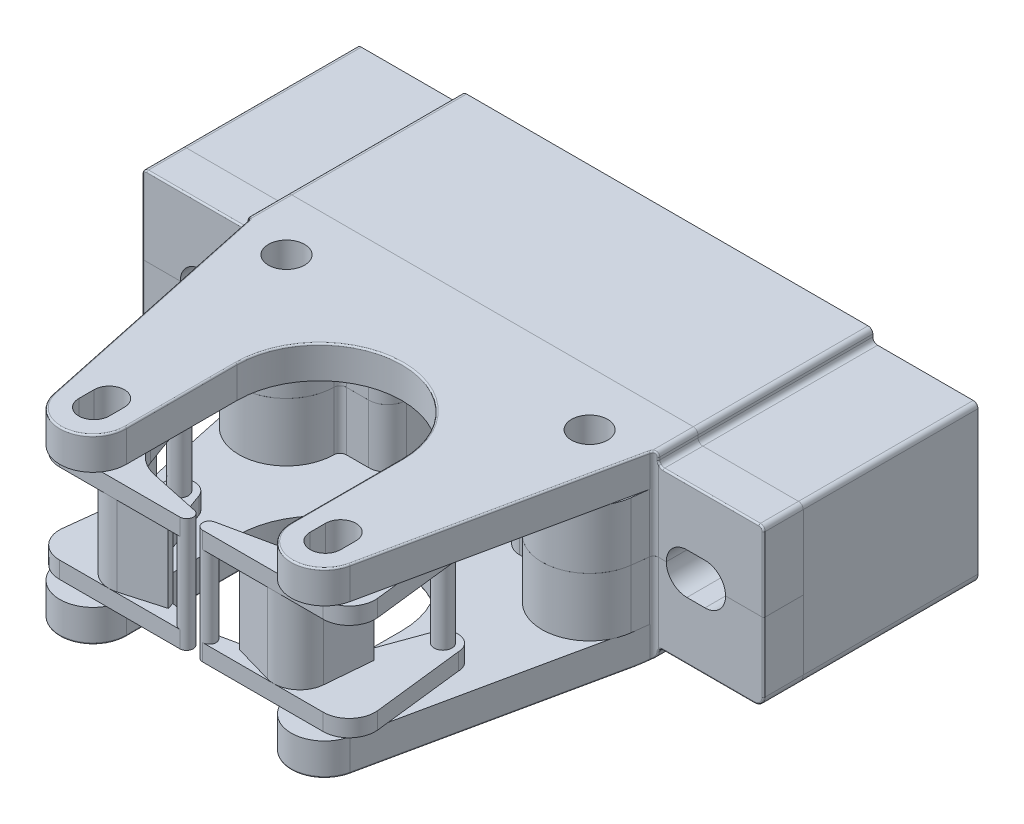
SolidWorks part; units mm, degrees
other "<elastic retainer>-<98291388.stp[4]>"
other "<elastic retainer>-<98291388.stp[3]>"
other "<elastic retainer>-<98291388.stp[2]>"
other "<elastic retainer>-<98291388.stp[1]>"
ref_plane "Front Plane" through (0, 0, 0) normal (0, 0, 1) x (1, 0, 0)
ref_plane "Top Plane" through (0, 0, 0) normal (0, 1, 0) x (1, 0, 0)
ref_plane "Right Plane" through (0, 0, 0) normal (1, 0, 0) x (0, 0, -1)
ref_plane "Front Plane-elastic retainer" through (-61.722, -4.7625, -25.4) normal (0, 0, 1) x (1, 0, 0)
ref_plane "Top Plane-elastic retainer" through (-61.722, -4.7625, -25.4) normal (0, 1, 0) x (1, 0, 0)
ref_plane "Right Plane-elastic retainer" through (-61.722, -4.7625, -25.4) normal (1, 0, 0) x (0, 0, -1)
inserted part "elastic retainer"
move or copy body "Body-Move/Copy2"
sketch "Sketch1" plane through (0, 0, 0) normal (0, 0, 1) x (1, 0, 0)
  line L0 (-45.085, 7.2771) -> (-45.585, 7.2771)
  line L1 (-45.585, 7.2771) -> (-43.6372, 7.2771) construction
  line L2 (-45.585, 8.9281) -> (-43.6372, 8.9281)
  line L3 (-45.585, 5.6261) -> (-43.6372, 5.6261)
  line L4 (-4.699, 7.2771) -> (-4.199, 7.2771)
  line L5 (-4.199, 7.2771) -> (-6.1468, 7.2771) construction
  line L6 (-4.199, 5.6261) -> (-6.1468, 5.6261)
  line L7 (-4.199, 8.9281) -> (-6.1468, 8.9281)
  line L68 (-8.0471, 13.589) -> (-0.381, 13.589) construction
  line L69 (0, 13.208) -> (0, 7.2771) construction
  line L71 (-4.699, 8.9281) -> (-6.1468, 8.9281) construction
  line L74 (-20.3708, 7.2779) -> (-20.3708, 11.9634) construction
  line L75 (-20.3708, 11.9634) -> (-29.4132, 11.9634) construction
  line L76 (-29.4132, 11.9634) -> (-29.4132, 7.2779) construction
  line L79 (-43.6372, 8.9281) -> (-45.085, 8.9281) construction
  line L81 (-49.784, 7.2771) -> (-49.784, 13.208) construction
  line L82 (-49.403, 13.589) -> (-41.7369, 13.589) construction
  line L83 (-41.3559, 13.97) -> (-41.3559, 14.1732) construction
  line L84 (-40.9749, 14.5542) -> (-8.8091, 14.5542) construction
  line L85 (-8.4281, 14.1732) -> (-8.4281, 13.97) construction
  line L86 (-9.1901, 0) -> (-40.5939, 0) construction
  line L87 (-41.723, 0.9652) -> (-49.022, 0.9652) construction
  line L88 (-49.784, 1.7272) -> (-49.784, 7.2771) construction
  line L90 (-45.085, 5.6261) -> (-43.6372, 5.6261) construction
  line L93 (-29.4132, 7.2763) -> (-29.4132, 2.5908) construction
  line L94 (-29.4132, 2.5908) -> (-20.3708, 2.5908) construction
  line L95 (-20.3708, 2.5908) -> (-20.3708, 7.2763) construction
  line L98 (-6.1468, 5.6261) -> (-4.699, 5.6261) construction
  line L100 (0, 7.2771) -> (0, 1.7272) construction
  line L101 (-0.762, 0.9652) -> (-8.061, 0.9652) construction
  line L102 (-8.0471, 13.589) -> (-0.381, 13.589)
  line L103 (0, 13.208) -> (0, 7.2771)
  line L105 (-4.699, 8.9281) -> (-6.1468, 8.9281) construction
  line L108 (-20.3708, 7.2779) -> (-20.3708, 11.9634)
  line L109 (-20.3708, 11.9634) -> (-29.4132, 11.9634)
  line L110 (-29.4132, 11.9634) -> (-29.4132, 7.2779)
  line L113 (-43.6372, 8.9281) -> (-45.085, 8.9281) construction
  line L115 (-49.784, 7.2771) -> (-49.784, 13.208)
  line L116 (-49.403, 13.589) -> (-41.7369, 13.589)
  line L117 (-41.3559, 13.97) -> (-41.3559, 14.1732)
  line L118 (-40.9749, 14.5542) -> (-8.8091, 14.5542)
  line L119 (-8.4281, 14.1732) -> (-8.4281, 13.97)
  line L120 (-9.1901, 0) -> (-40.5939, 0)
  line L121 (-41.723, 0.9652) -> (-49.022, 0.9652)
  line L122 (-49.784, 1.7272) -> (-49.784, 7.2771)
  line L124 (-45.085, 5.6261) -> (-43.6372, 5.6261) construction
  line L127 (-29.4132, 7.2763) -> (-29.4132, 2.5908)
  line L128 (-29.4132, 2.5908) -> (-20.3708, 2.5908)
  line L129 (-20.3708, 2.5908) -> (-20.3708, 7.2763)
  line L132 (-6.1468, 5.6261) -> (-4.699, 5.6261) construction
  line L134 (0, 7.2771) -> (0, 1.7272)
  line L135 (-0.762, 0.9652) -> (-8.061, 0.9652)
  arc A1 (-45.585, 8.9281) -> (-45.585, 5.6261) centre (-45.585, 7.2771) ccw
  arc A2 (-43.6372, 5.6261) -> (-43.6372, 8.9281) centre (-43.6372, 7.2771) ccw
  arc A3 (-4.199, 5.6261) -> (-4.199, 8.9281) centre (-4.199, 7.2771) ccw
  arc A4 (-6.1468, 8.9281) -> (-6.1468, 5.6261) centre (-6.1468, 7.2771) ccw
  arc A40 (0, 13.208) -> (-0.381, 13.589) centre (-0.381, 13.208) ccw construction
  arc A41 (-3.048, 7.2771) -> (-4.699, 8.9281) centre (-4.699, 7.2771) ccw construction
  arc A42 (-6.1468, 8.9281) -> (-7.7978, 7.2771) centre (-6.1468, 7.2771) ccw construction
  arc A43 (-41.9862, 7.2771) -> (-43.6372, 8.9281) centre (-43.6372, 7.2771) ccw construction
  arc A44 (-45.085, 8.9281) -> (-46.736, 7.2771) centre (-45.085, 7.2771) ccw construction
  arc A45 (-49.403, 13.589) -> (-49.784, 13.208) centre (-49.403, 13.208) ccw construction
  arc A46 (-41.7369, 13.589) -> (-41.3559, 13.97) centre (-41.7369, 13.97) ccw construction
  arc A47 (-40.9749, 14.5542) -> (-41.3559, 14.1732) centre (-40.9749, 14.1732) ccw construction
  arc A48 (-8.4281, 14.1732) -> (-8.8091, 14.5542) centre (-8.8091, 14.1732) ccw construction
  arc A49 (-8.4281, 13.97) -> (-8.0471, 13.589) centre (-8.0471, 13.97) ccw construction
  arc A50 (-41.3466, 0.6435) -> (-40.5939, 0) centre (-40.5939, 0.762) ccw construction
  arc A51 (-41.3466, 0.6435) -> (-41.723, 0.9652) centre (-41.723, 0.5842) ccw construction
  arc A52 (-49.784, 1.7272) -> (-49.022, 0.9652) centre (-49.022, 1.7272) ccw construction
  arc A53 (-46.736, 7.2771) -> (-45.085, 5.6261) centre (-45.085, 7.2771) ccw construction
  arc A54 (-43.6372, 5.6261) -> (-41.9862, 7.2771) centre (-43.6372, 7.2771) ccw construction
  arc A55 (-7.7978, 7.2771) -> (-6.1468, 5.6261) centre (-6.1468, 7.2771) ccw construction
  arc A56 (-4.699, 5.6261) -> (-3.048, 7.2771) centre (-4.699, 7.2771) ccw construction
  arc A57 (-0.762, 0.9652) -> (0, 1.7272) centre (-0.762, 1.7272) ccw construction
  arc A58 (-8.061, 0.9652) -> (-8.4374, 0.6435) centre (-8.061, 0.5842) ccw construction
  arc A59 (-9.1901, 0) -> (-8.4374, 0.6435) centre (-9.1901, 0.762) ccw construction
  arc A60 (0, 13.208) -> (-0.381, 13.589) centre (-0.381, 13.208) ccw
  arc A61 (-3.048, 7.2771) -> (-4.699, 8.9281) centre (-4.699, 7.2771) ccw construction
  arc A62 (-6.1468, 8.9281) -> (-7.7978, 7.2771) centre (-6.1468, 7.2771) ccw construction
  arc A63 (-41.9862, 7.2771) -> (-43.6372, 8.9281) centre (-43.6372, 7.2771) ccw construction
  arc A64 (-45.085, 8.9281) -> (-46.736, 7.2771) centre (-45.085, 7.2771) ccw construction
  arc A65 (-49.403, 13.589) -> (-49.784, 13.208) centre (-49.403, 13.208) ccw
  arc A66 (-41.7369, 13.589) -> (-41.3559, 13.97) centre (-41.7369, 13.97) ccw
  arc A67 (-40.9749, 14.5542) -> (-41.3559, 14.1732) centre (-40.9749, 14.1732) ccw
  arc A68 (-8.4281, 14.1732) -> (-8.8091, 14.5542) centre (-8.8091, 14.1732) ccw
  arc A69 (-8.4281, 13.97) -> (-8.0471, 13.589) centre (-8.0471, 13.97) ccw
  arc A70 (-41.3466, 0.6435) -> (-40.5939, 0) centre (-40.5939, 0.762) ccw
  arc A71 (-41.3466, 0.6435) -> (-41.723, 0.9652) centre (-41.723, 0.5842) ccw
  arc A72 (-49.784, 1.7272) -> (-49.022, 0.9652) centre (-49.022, 1.7272) ccw
  arc A73 (-46.736, 7.2771) -> (-45.085, 5.6261) centre (-45.085, 7.2771) ccw construction
  arc A74 (-43.6372, 5.6261) -> (-41.9862, 7.2771) centre (-43.6372, 7.2771) ccw construction
  arc A75 (-7.7978, 7.2771) -> (-6.1468, 5.6261) centre (-6.1468, 7.2771) ccw construction
  arc A76 (-4.699, 5.6261) -> (-3.048, 7.2771) centre (-4.699, 7.2771) ccw construction
  arc A77 (-0.762, 0.9652) -> (0, 1.7272) centre (-0.762, 1.7272) ccw
  arc A78 (-8.061, 0.9652) -> (-8.4374, 0.6435) centre (-8.061, 0.5842) ccw
  arc A79 (-9.1901, 0) -> (-8.4374, 0.6435) centre (-9.1901, 0.762) ccw
  point P4 (-44.6111, 7.2771)
  point P17 (-5.1729, 7.2771)
  dimension "D1" = 0.5
  dimension "D2" = 0.5
extrude "Boss-Extrude1" add sketch "Sketch1" against normal blind 14 separate body
